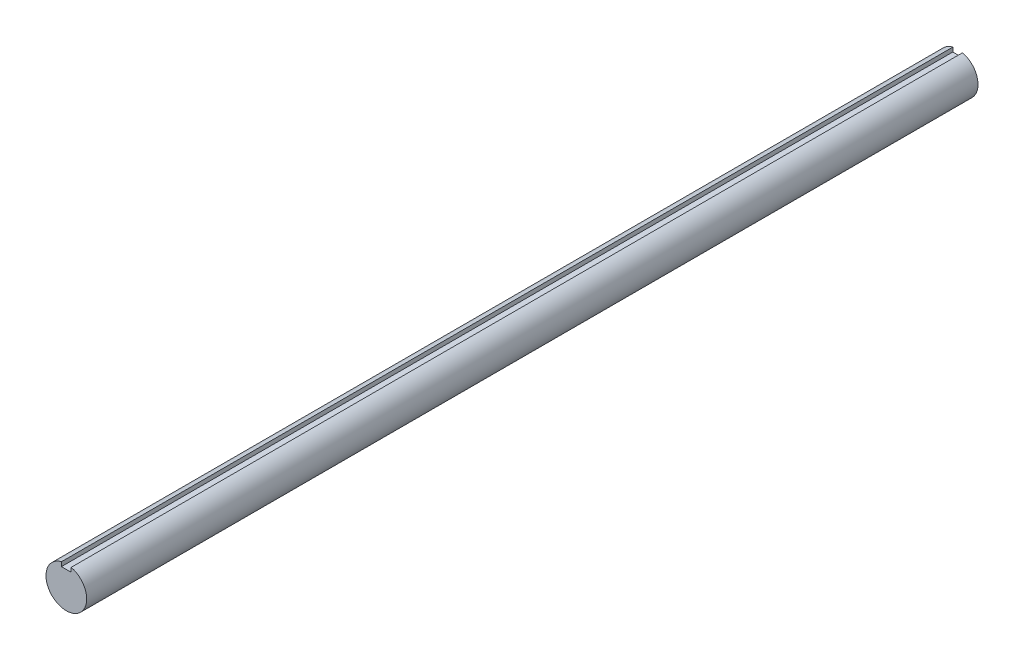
SolidWorks part; units mm, degrees
ref_plane "Front Plane" through (0, 0, 0) normal (0, 0, 1) x (1, 0, 0)
ref_plane "Top Plane" through (0, 0, 0) normal (0, 1, 0) x (1, 0, 0)
ref_plane "Right Plane" through (0, 0, 0) normal (1, 0, 0) x (0, 0, -1)
sketch "Sketch1" plane through (0, 0, 0) normal (0, 0, 1) x (1, 0, 0)
  line L0 (1.905, 7.7055) -> (1.905, 6.0325)
  line L1 (1.905, 6.0325) -> (-1.905, 6.0325)
  line L2 (-1.905, 6.0325) -> (-1.905, 7.7055)
  line L3 (0, 0) -> (0, 6.0325) construction
  arc A0 (-1.905, 7.7055) -> (1.905, 7.7055) centre (0, 0) ccw
  dimension "D1" = 7.9375
  dimension "D2" = 6.0325
  dimension "D3" = 3.81
extrude "Extrude1" add sketch "Sketch1" along normal mid plane 347.9267
